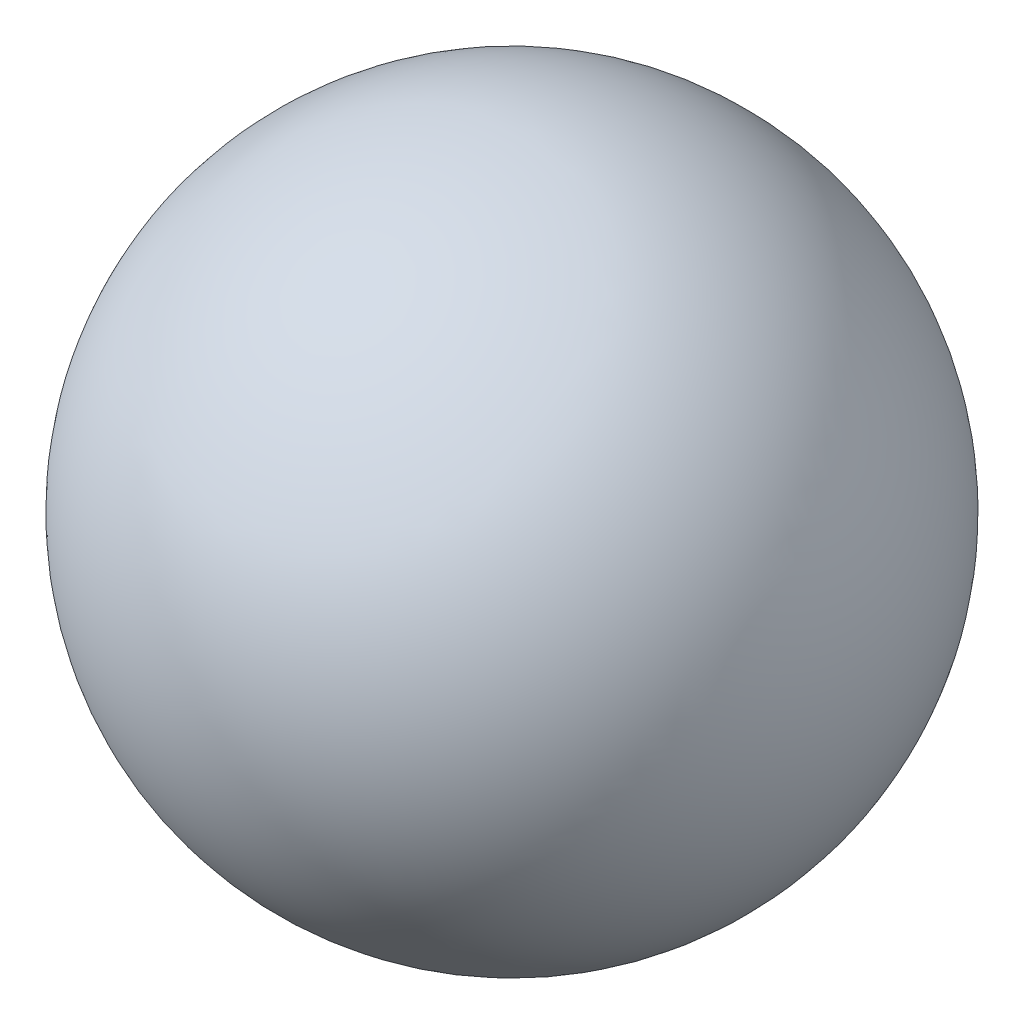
SolidWorks part; units mm, degrees
ref_plane "Front" through (0, 0, 0) normal (0, 0, 1) x (1, 0, 0)
ref_plane "Top" through (0, 0, 0) normal (0, 1, 0) x (1, 0, 0)
ref_plane "Right" through (0, 0, 0) normal (1, 0, 0) x (0, 0, -1)
sketch "Esquisse1" plane through (0, 0, 0) normal (0, 0, 1) x (1, 0, 0)
  line L0 (-12.7509, 0) -> (20.7697, 0) construction
  line L1 (-3.97, 0) -> (3.97, 0)
  arc A0 (3.97, 0) -> (-3.97, 0) centre (0, 0) ccw
  dimension "D1" = 7.94
revolve "Révolution1" add sketch "Esquisse1" angle 360 about L0
